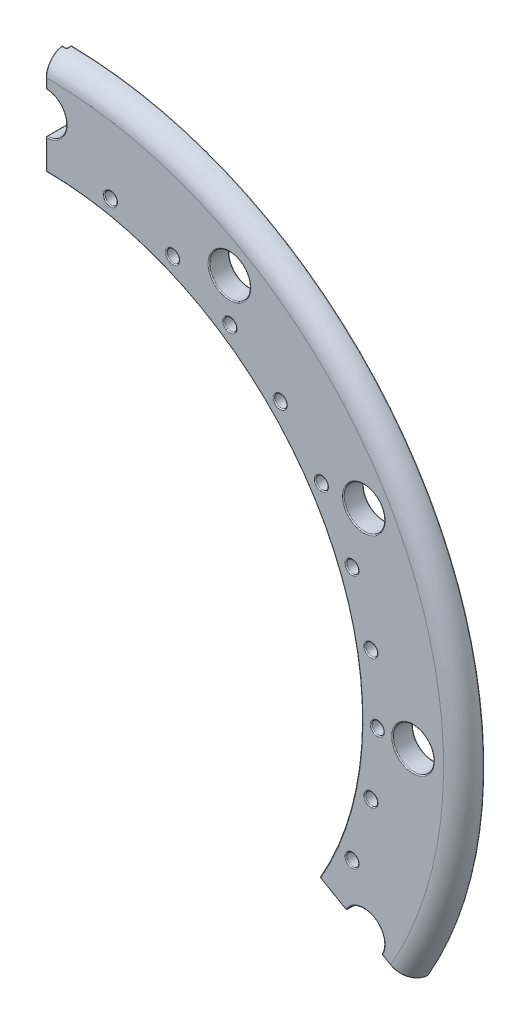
SolidWorks part; units mm, degrees
ref_plane "Спереди" through (0, 0, 0) normal (0, 0, 1) x (1, 0, 0)
ref_plane "Сверху" through (0, 0, 0) normal (0, 1, 0) x (1, 0, 0)
ref_plane "Справа" through (0, 0, 0) normal (1, 0, 0) x (0, 0, -1)
sketch "Эскиз1" plane through (0, 0, 0) normal (0, 0, 1) x (1, 0, 0)
  line L0 (0, 0) -> (0, 170) construction
  line L1 (0, 0) -> (147.2243, -85) construction
  line L2 (90, 155.8846) -> (0, 0) construction
  line L3 (0, 205) -> (0, 190)
  line L4 (134.2339, -77.5) -> (147.2243, -85)
  line L5 (0, 0) -> (155.8846, 90) construction
  line L6 (180, 0) -> (0, 0) construction
  line L7 (0, 190) -> (0, 205) construction
  line L8 (0, 170) -> (0, 155)
  line L9 (164.5448, -95) -> (177.5352, -102.5) construction
  line L10 (164.5448, -95) -> (177.5352, -102.5)
  line L11 (0, 0) -> (31.7022, 159.3776) construction
  line L12 (0, 0) -> (31.7022, 159.3776) construction
  line L13 (0, 0) -> (62.1861, 150.1304) construction
  arc A0 (177.5352, -102.5) -> (0, 205) centre (0, 0) ccw
  arc A1 (134.2339, -77.5) -> (0, 155) centre (0, 0) ccw
  circle A2 centre (0, 0) radius 205 construction
  circle A3 centre (0, 0) radius 155 construction
  arc A4 (155.8846, -90) -> (0, 180) centre (0, 0) ccw construction
  arc A5 (164.5448, -95) -> (147.2243, -85) centre (155.8846, -90) ccw
  arc A6 (0, 170) -> (0, 190) centre (0, 180) ccw
  circle A7 centre (155.8846, 90) radius 10
  circle A8 centre (180, 0) radius 10
  circle A9 centre (90, 155.8846) radius 10
  circle A10 centre (0, 0) radius 162.5 construction
  circle A11 centre (31.7022, 159.3776) radius 3
  circle A12 centre (62.1861, 150.1304) radius 3
  circle A13 centre (90.2802, 135.1138) radius 3
  circle A14 centre (114.9049, 114.9049) radius 3
  circle A15 centre (135.1138, 90.2802) radius 3
  circle A16 centre (150.1304, 62.1861) radius 3
  circle A17 centre (159.3776, 31.7022) radius 3
  circle A18 centre (162.5, 0) radius 3
  circle A19 centre (159.3776, -31.7022) radius 3
  circle A20 centre (150.1304, -62.1861) radius 3
  point P12 (140.7291, -81.25)
  dimension "D1" = 410
  dimension "D5" = 20
  dimension "D9" = 6
  dimension "D2" = 120
  dimension "D6" = 30
  dimension "D7" = 30
  dimension "D8" = 30
  dimension "D10" = 11.25
  dimension "D12" = 11.25
  dimension "D13" = 22.5
  dimension "D3" = 50
  dimension "D4" = 25
  dimension "D11" = 10
extrude "Бобышка-Вытянуть1" add sketch "Эскиз1" along normal mid plane 10
fillet "Скругление1" radius 10 1 edges at (177.5352, 102.5, 5)
fillet "Скругление2" radius 0.5 49 edges at (134.2339, 77.5, 5) (134.2339, 77.5, -5) (153.1304, -62.1861, -5) (153.1304, -62.1861, 5) (162.3776, -31.7022, -5) (162.3776, -31.7022, 5) (165.5, 0, -5) (165.5, 0, 5) (162.3776, 31.7022, -5) (162.3776, 31.7022, 5) (153.1304, 62.1861, -5) (153.1304, 62.1861, 5) (138.1138, 90.2802, -5) (138.1138, 90.2802, 5) (117.9049, 114.9049, -5) (117.9049, 114.9049, 5) (93.2802, 135.1138, -5) (93.2802, 135.1138, 5) (65.1861, 150.1304, -5) (65.1861, 150.1304, 5) (34.7022, 159.3776, -5) (34.7022, 159.3776, 5) (0, 162.5, 5) (0, 155, 0) (0, 162.5, -5) (0, 197.5, -5) (0, 202.0711, 2.0711) (0, 192.5, 5) (166.7099, -96.25, 5) (174.9987, -101.0355, 2.0711) (171.04, -98.75, -5) (134.2339, -77.5, 0) (140.7291, -81.25, 5) (140.7291, -81.25, -5) (147.2243, -85, 0) (160.8846, -81.3397, 5) (164.5448, -95, 0) (160.8846, -81.3397, -5) (190, 0, -5) (190, 0, 5) (165.8846, 90, -5) (165.8846, 90, 5) (100, 155.8846, -5) (100, 155.8846, 5) (0, 190, 0) (10, 180, 5) (0, 170, 0) (10, 180, -5) (177.5352, 102.5, -5)
sketch "Эскиз2" plane through (0, 0, 0) normal (-1, 0, 0) x (0, 0, 1)
  line L12 (-3, 201) -> (-15, 201)
  line L13 (-15, 201) -> (-15, 198)
  line L14 (-15, 198) -> (-3, 198.6)
  line L15 (-3, 198.6) -> (-3, 201)
  line L20 (-3, 201) -> (-15, 201)
  line L21 (-15, 201) -> (-15, 198)
  line L22 (-15, 198) -> (-3, 198.6)
  line L23 (-3, 198.6) -> (-3, 201)
  dimension "D1" = 0
revolve "Вырез-Повернуть1" cut sketch "Эскиз2" angle 360 about L20
ref_plane "Плоскость1" through (0, 201, 0) normal (0, 1, 0) x (-1, 0, 0)
sketch "Эскиз4" plane through (0, 201, 0) normal (0, 1, 0) x (-1, 0, 0)
  line L0 (2.4, -3) -> (3, -15) construction
  line L1 (-3, -15) -> (3, -15) construction
  line L2 (-2.4, -3) -> (-3, -15) construction
  line L3 (2.4, -3) -> (-2.4, -3) construction
  line L4 (2.4, -3) -> (3, -15)
  line L5 (-3, -15) -> (3, -15)
  line L6 (-2.4, -3) -> (-3, -15)
  line L7 (2.4, -3) -> (-2.4, -3)
extrude "Вырез-Вытянуть2" cut sketch "Эскиз4" along normal through all
fillet "Скругление3" radius 0.5 11 edges at (1.6971, 199.3029, -3) (0, 201.4432, -3) (0.1934, 204.6901, -3) (0, 198.5625, -3.75) (0.1095, 198.5118, -4.8123) (1.9365, 199.4189, -5) (2.5, 202.7358, -5) (2.4935, 204.8078, -4.8702) (2.4, 202.8919, -3) (1.4506, 204.7928, -3)
